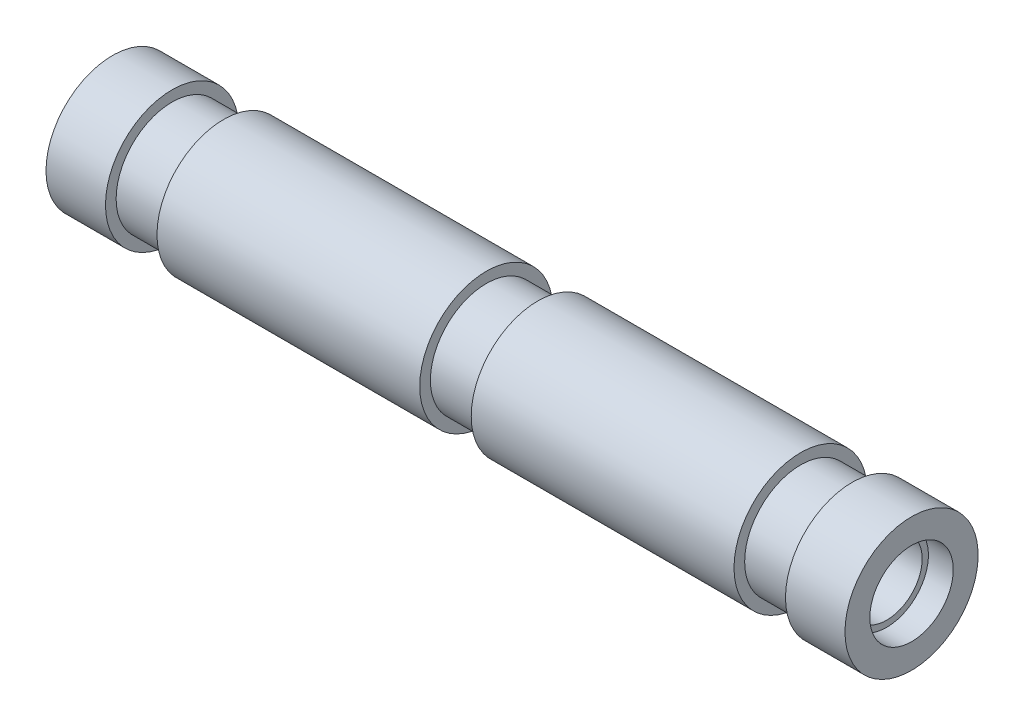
SolidWorks part; units mm, degrees
ref_plane "Plan de face" through (0, 0, 0) normal (0, 0, 1) x (1, 0, 0)
ref_plane "Plan de dessus" through (0, 0, 0) normal (0, 1, 0) x (1, 0, 0)
ref_plane "Plan de droite" through (0, 0, 0) normal (1, 0, 0) x (0, 0, -1)
sketch "Esquisse1" plane through (0, 0, 0) normal (0, 0, 1) x (1, 0, 0)
  line L0 (-225, 23.5) -> (-211, 23.5)
  line L1 (-211, 23.5) -> (-211, 20)
  line L2 (-211, 20) -> (211, 20)
  line L3 (211, 20) -> (211, 23.5)
  line L4 (211, 23.5) -> (225, 23.5)
  line L5 (225, 23.5) -> (225, 37.5)
  line L6 (225, 37.5) -> (191.5, 37.5)
  line L7 (191.5, 37.5) -> (191.5, 31.5)
  line L8 (191.5, 31.5) -> (162.5, 31.5)
  line L9 (162.5, 31.5) -> (162.5, 37.5)
  line L10 (162.5, 37.5) -> (14.5, 37.5)
  line L11 (14.5, 37.5) -> (14.5, 31.5)
  line L12 (14.5, 31.5) -> (-14.5, 31.5)
  line L13 (-14.5, 31.5) -> (-14.5, 37.5)
  line L14 (-14.5, 37.5) -> (-162.5, 37.5)
  line L15 (-162.5, 37.5) -> (-162.5, 31.5)
  line L16 (-162.5, 31.5) -> (-191.5, 31.5)
  line L17 (-191.5, 31.5) -> (-191.5, 37.5)
  line L18 (-191.5, 37.5) -> (-225, 37.5)
  line L19 (-225, 37.5) -> (-225, 23.5)
  line L20 (-245.902, 0) -> (238.041, 0) construction
  point P23 (0, 20)
  dimension "D1" = 450
  dimension "D2" = 33.5
  dimension "D3" = 29
  dimension "D4" = 148
  dimension "D5" = 29
  dimension "D6" = 148
  dimension "D7" = 29
  dimension "D8" = 14
  dimension "D9" = 14
  dimension "D10" = 40
  dimension "D11" = 47
  dimension "D12" = 75
  dimension "D13" = 63
revolve "Révolution1" add sketch "Esquisse1" angle 360 about L20
